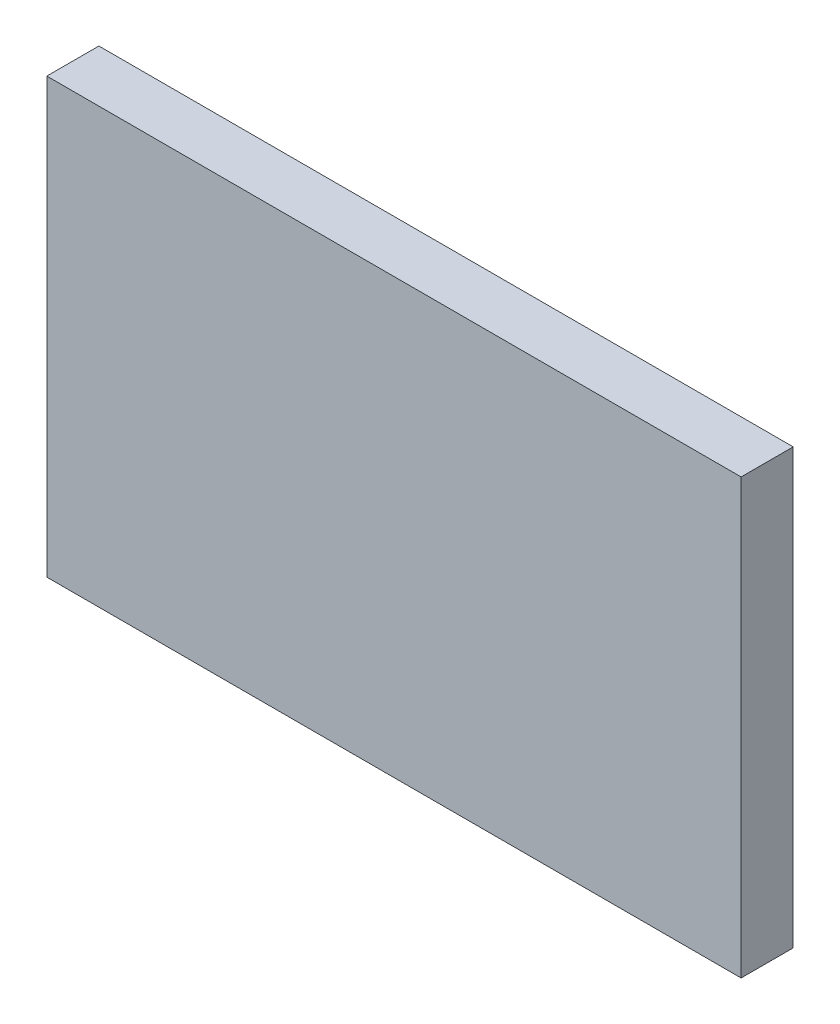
SolidWorks part; units mm, degrees
ref_plane "Front" through (0, 0, 0) normal (0, 0, 1) x (1, 0, 0)
ref_plane "Top" through (0, 0, 0) normal (0, 1, 0) x (1, 0, 0)
ref_plane "Right" through (0, 0, 0) normal (1, 0, 0) x (0, 0, -1)
sketch "Sketch1" plane through (0, 0, 0) normal (0, 0, 1) x (1, 0, 0)
  line L1 (0, 0) -> (101.6, 0)
  line L2 (0, 0) -> (0, 63.5)
  line L3 (0, 63.5) -> (101.6, 63.5)
  line L4 (101.6, 0) -> (101.6, 63.5)
  dimension "D1" = 101.6
  dimension "D2" = 63.5
extrude "Extrude1" add sketch "Sketch1" along normal blind 7.62
sketch "Sketch2" plane through (0, 0, 0) normal (0, 0, -1) x (-1, 0, 0)
  line L0 (0, 63.5) -> (0, 0) construction
  line L1 (-63.5, 41.275) -> (-58.42, 41.275)
  line L2 (-63.5, 41.275) -> (-63.5, 22.0309)
  line L3 (-63.5, 22.0309) -> (-58.42, 22.0309)
  line L4 (-58.42, 41.275) -> (-58.42, 22.0309)
  line L5 (-43.18, 41.275) -> (-38.1, 41.275)
  line L6 (-43.18, 41.275) -> (-43.18, 22.225)
  line L7 (-43.18, 22.225) -> (-38.1, 22.225)
  line L8 (-38.1, 41.275) -> (-38.1, 22.225)
  line L9 (0, 0) -> (-101.6, 0) construction
  dimension "D1" = 5.08
  dimension "D2" = 5.08
  dimension "D3" = 15.24
  dimension "D4" = 38.1
  dimension "D5" = 19.05
  dimension "D6" = 22.225
extrude "Extrude2" add sketch "Sketch2" along normal blind 20.32
fillet "Fillet1" radius 5.08
sketch "Sketch3" plane through (58.42, 0, 0) normal (-1, 0, 0) x (0, 0, 1)
  line L0 (0, 16.9509) -> (0, 46.355) construction
  line L1 (-15.24, 41.275) -> (-5.08, 41.275) construction
  circle A0 centre (-12.7, 31.75) radius 6.3303
  dimension "D1" = 12.7
  dimension "D2" = 9.525
extrude "Extrude3" add sketch "Sketch3" along normal up to next
